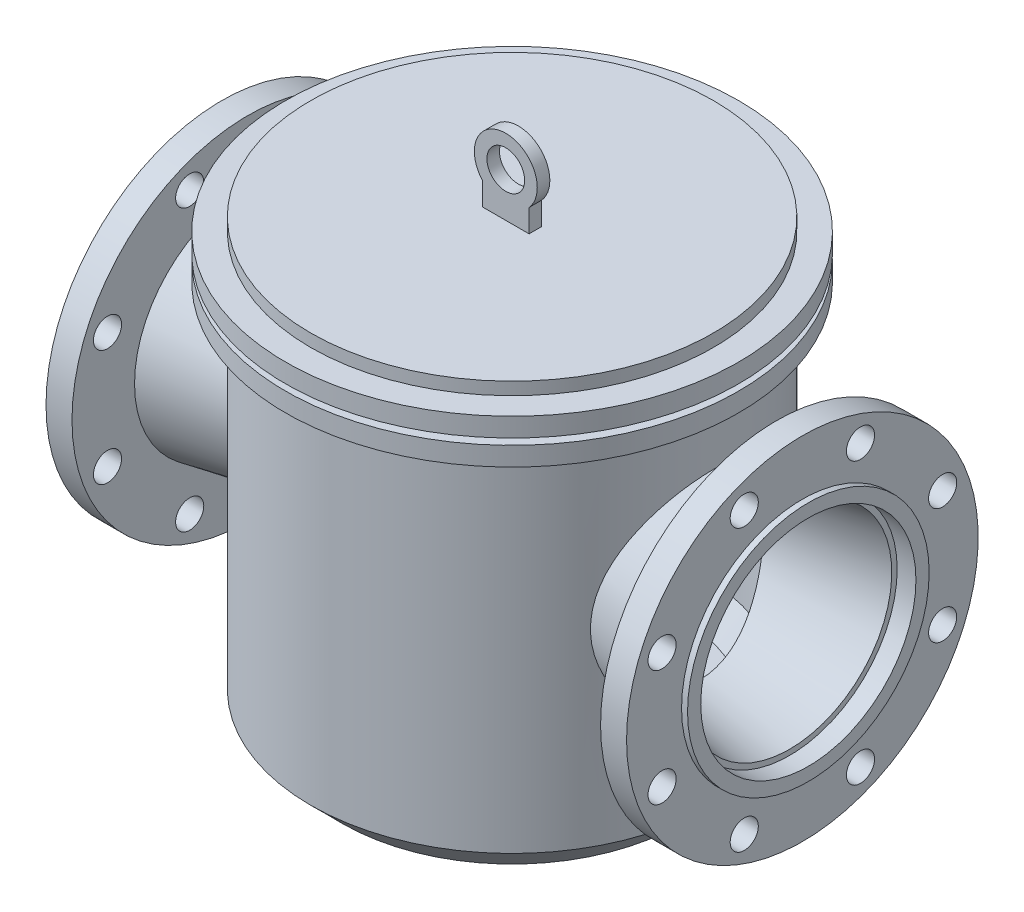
SolidWorks part; units mm, degrees
ref_plane "Front" through (0, 0, 0) normal (0, 0, 1) x (1, 0, 0)
ref_plane "Top" through (0, 0, 0) normal (0, 1, 0) x (1, 0, 0)
ref_plane "Right" through (0, 0, 0) normal (1, 0, 0) x (0, 0, -1)
sketch "Sketch1" plane through (0, 0, 0) normal (0, 0, 1) x (1, 0, 0)
  line L0 (0, -64.0794) -> (0, 96.1191) construction
  line L1 (0, -185) -> (50, -185)
  line L2 (50, -185) -> (50, -175)
  line L3 (50, -175) -> (135, -175)
  line L4 (135, -175) -> (160, -150)
  line L5 (160, -150) -> (160, 175)
  line L6 (160, 175) -> (0, 175)
  line L8 (0, 0) -> (119.9736, 0) construction
  line L15 (0, -185) -> (0, 175)
  dimension "D1" = 160
  dimension "D2" = 175
  dimension "D3" = 175
  dimension "D4" = 25
  dimension "D5" = 135
  dimension "D6" = 50
  dimension "D7" = 10
revolve "Base-Revolve" add sketch "Sketch1" angle 360 about L0
sketch "Sketch2" plane through (0, 0, 0) normal (0, 0, 1) x (1, 0, 0)
  line L0 (160, -150) -> (160, 175) construction
  line L1 (160, 165) -> (180, 165)
  line L2 (160, 165) -> (160, 150)
  line L3 (160, 150) -> (180, 150)
  line L4 (180, 165) -> (180, 150)
  line L5 (160, 145) -> (180, 145)
  line L6 (160, 145) -> (160, 130)
  line L7 (160, 130) -> (180, 130)
  line L8 (180, 145) -> (180, 130)
  line L9 (160, 175) -> (-160, 175) construction
  line L10 (0, 0) -> (0, 185.8464) construction
  dimension "D1" = 15
  dimension "D2" = 5
  dimension "D3" = 20
  dimension "D4" = 10
revolve "Boss-Revolve1" add sketch "Sketch2" angle 360 about L10
sketch "Sketch3" plane through (0, 0, 0) normal (0, 0, 1) x (1, 0, 0)
  line L0 (0, 0) -> (283.0144, 0) construction
  line L1 (0, 0) -> (0, 52.9713)
  line L2 (0, -64.0794) -> (0, 96.1191) construction
  line L3 (0, 52.9713) -> (210, 90)
  line L4 (210, 90) -> (210, 139.7)
  line L5 (210, 139.7) -> (230.65, 139.7)
  line L6 (230.65, 139.7) -> (230.65, 96)
  line L7 (230.65, 96) -> (235.4, 96)
  line L8 (235.4, 96) -> (235.4, 0)
  line L9 (235.4, 0) -> (0, 0)
  dimension "D1" = 210
  dimension "D2" = 96
  dimension "D3" = 4.75
  dimension "D4" = 20.65
  dimension "D5" = 139.7
  dimension "D6" = 90
  dimension "D7" = 100
revolve "Boss-Revolve2" add sketch "Sketch3" angle 360 about L0
mirror "Mirror1" about plane through (0, 0, 0) normal (1, 0, 0) of "Boss-Revolve2"
shell "Shell1" thickness 10.5
sketch "Sketch5" plane through (230.65, 0, 0) normal (1, 0, 0) x (0, 0, -1)
  line L1 (0, 0) -> (0, 158.3439) construction
  line L2 (0, 0) -> (-46.1708, 111.4661) construction
  circle A0 centre (-46.1708, 111.4661) radius 11.175
  dimension "D1" = 22.35
  dimension "D2" = 120.65
  dimension "D3" = 22.5
extrude "Cut-Extrude1" cut sketch "Sketch5" against normal up to next
pattern_circular "CirPattern1" count 8 over 360 about axis through (0, 0, 0) along (1, 0, 0) of "Cut-Extrude1"
sketch "Sketch6" plane through (-230.65, 0, 0) normal (-1, 0, 0) x (0, 0, 1)
  circle A0 centre (46.1708, 111.4661) radius 11.175 construction
  circle A1 centre (46.1708, 111.4661) radius 11.175
extrude "Cut-Extrude2" cut sketch "Sketch6" against normal up to next
pattern_circular "CirPattern3" count 8 over 360 about axis through (0, 0, 0) along (1, 0, 0) of "Cut-Extrude2"
sketch "Sketch7" plane through (0, 0, 0) normal (0, 0, 1) x (1, 0, 0)
  line L0 (0, 0) -> (0, 290.4191) construction
  line L1 (0, 164.5) -> (0, -145.6508) construction
  line L2 (-18.5, 175) -> (18.5, 175)
  line L3 (18.5, 175) -> (18.5, 193.1848)
  line L4 (-18.5, 175) -> (-18.5, 193.1848)
  line L5 (160, 175) -> (-160, 175) construction
  arc A0 (-18.5, 193.1848) -> (18.5, 193.1848) centre (0, 210) cw
  circle A1 centre (0, 210) radius 15
  point P8 (0, 175)
  dimension "D1" = 25
  dimension "D2" = 30
  dimension "D3" = 37
  dimension "D4" = 35
extrude "Boss-Extrude1" add sketch "Sketch7" along normal mid plane 10
sketch "Sketch8" plane through (0, 0, 0) normal (0, 0, 1) x (1, 0, 0)
  point P0 (0, 0)
other "RPoint1"
